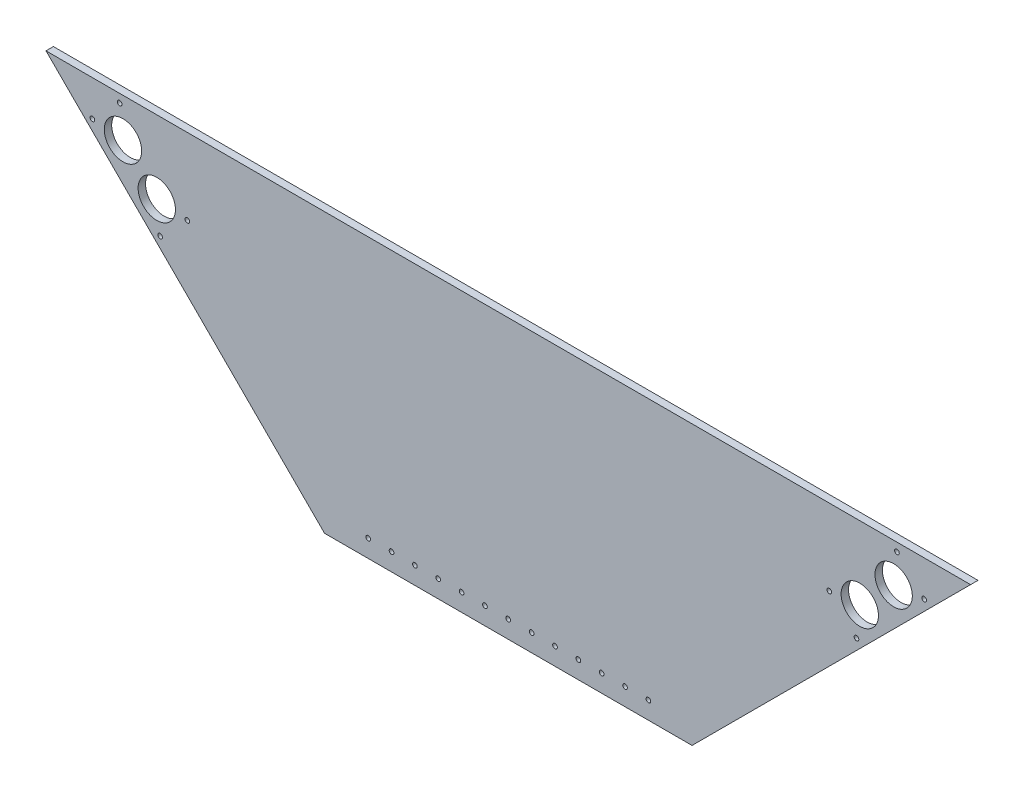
SolidWorks part; units mm, degrees
ref_plane "Front Plane" through (0, 0, 0) normal (0, 0, 1) x (1, 0, 0)
ref_plane "Top Plane" through (0, 0, 0) normal (0, 1, 0) x (1, 0, 0)
ref_plane "Right Plane" through (0, 0, 0) normal (1, 0, 0) x (0, 0, -1)
sketch "Sketch1" plane through (0, 0, 0) normal (0, 0, 1) x (1, 0, 0)
  line L0 (-197.965, 119.28) -> (197.965, 119.28)
  line L1 (-197.965, 119.28) -> (-78.685, 0)
  line L2 (-78.685, 0) -> (78.685, 0)
  line L3 (0, 0) -> (0, 119.28) construction
  line L4 (197.965, 119.28) -> (78.685, 0)
  dimension "D1" = 197.965
  dimension "D2" = 135
  dimension "D3" = 119.28
extrude "Boss-Extrude1" add sketch "Sketch1" along normal blind 3.175 contours L4 L2 L1 L0
sketch "Horizontal Ultrasonic" plane through (0, 0, 3.175) normal (0, 0, 1) x (1, 0, 0)
  line L0 (-55.7558, 1.9375) -> (-55.7558, 21.9375) construction
  line L1 (-78.2558, 21.9375) -> (-33.2558, 21.9375) construction
  line L2 (-78.2558, 21.9375) -> (-78.2558, 1.9375) construction
  line L3 (-78.2558, 1.9375) -> (-33.2558, 1.9375) construction
  line L4 (-33.2558, 21.9375) -> (-33.2558, 1.9375) construction
  line L5 (-78.2558, 11.9375) -> (-33.2558, 11.9375) construction
  circle A0 centre (-68.0058, 11.9375) radius 6.214
  circle A1 centre (-43.5058, 11.9375) radius 6.214
  circle A2 centre (-76.2558, 3.6875) radius 1
  circle A3 centre (-76.2558, 20.1875) radius 1
  circle A4 centre (-35.2558, 20.1875) radius 1
  circle A5 centre (-35.2558, 3.6875) radius 1
  point P7 (-78.2558, 11.9375)
  dimension "D4" = 2
  dimension "D5" = 16.5
  dimension "D1" = 45
  dimension "D2" = 20
  dimension "D3" = 10.25
  dimension "D6" = 41
sketch "Rotated Ultrasonic" plane through (0, 0, 3.175) normal (0, 0, 1) x (1, 0, 0)
  line L0 (-178.0962, 104.0032) -> (-149.1049, 75.0119) construction
  line L1 (-149.1049, 75.0119) -> (-137.4376, 86.6791) construction
  line L2 (-137.4376, 86.6791) -> (-166.429, 115.6705) construction
  line L3 (-166.429, 115.6705) -> (-178.0962, 104.0032) construction
  line L4 (-163.6005, 89.5075) -> (-151.9333, 101.1748) construction
  line L5 (-172.2626, 109.8369) -> (-143.2712, 80.8455) construction
  circle A0 centre (-165.0148, 102.589) radius 8
  circle A5 centre (-178.0962, 104.0032) radius 1
  circle A6 centre (-166.429, 115.6705) radius 1
  circle A7 centre (-137.4376, 86.6791) radius 1
  circle A8 centre (-149.1049, 75.0119) radius 1
  circle A9 centre (-150.5191, 88.0933) radius 8
  dimension "D5" = 16
  dimension "D6" = 2
  dimension "D1" = 41
  dimension "D2" = 16.5
  dimension "D3" = 10.25
  dimension "D4" = 8.25
sketch "Pole Mounting Holes" plane through (0, 0, 3.175) normal (0, 0, 1) x (1, 0, 0)
  line L0 (-78.685, 0) -> (78.685, 0) construction
  circle A0 centre (0, 7.5) radius 1
  circle A1 centre (10, 7.5) radius 1
  circle A2 centre (20, 7.5) radius 1
  circle A3 centre (30, 7.5) radius 1
  circle A4 centre (40, 7.5) radius 1
  circle A5 centre (50, 7.5) radius 1
  circle A6 centre (60, 7.5) radius 1
  circle A7 centre (-10, 7.5) radius 1
  circle A8 centre (-20, 7.5) radius 1
  circle A9 centre (-30, 7.5) radius 1
  circle A10 centre (-40, 7.5) radius 1
  circle A11 centre (-50, 7.5) radius 1
  circle A12 centre (-60, 7.5) radius 1
  dimension "D1" = 2
  dimension "D3" = 7
  dimension "D2" = 7.5
  dimension "D4" = 7
extrude "Cut-Extrude1" cut sketch "Pole Mounting Holes" against normal through all
extrude "Cut-Extrude2" cut sketch "Rotated Ultrasonic" against normal through all
mirror "Mirror1" about plane through (0, 0, 0) normal (1, 0, 0) of "Cut-Extrude2"
